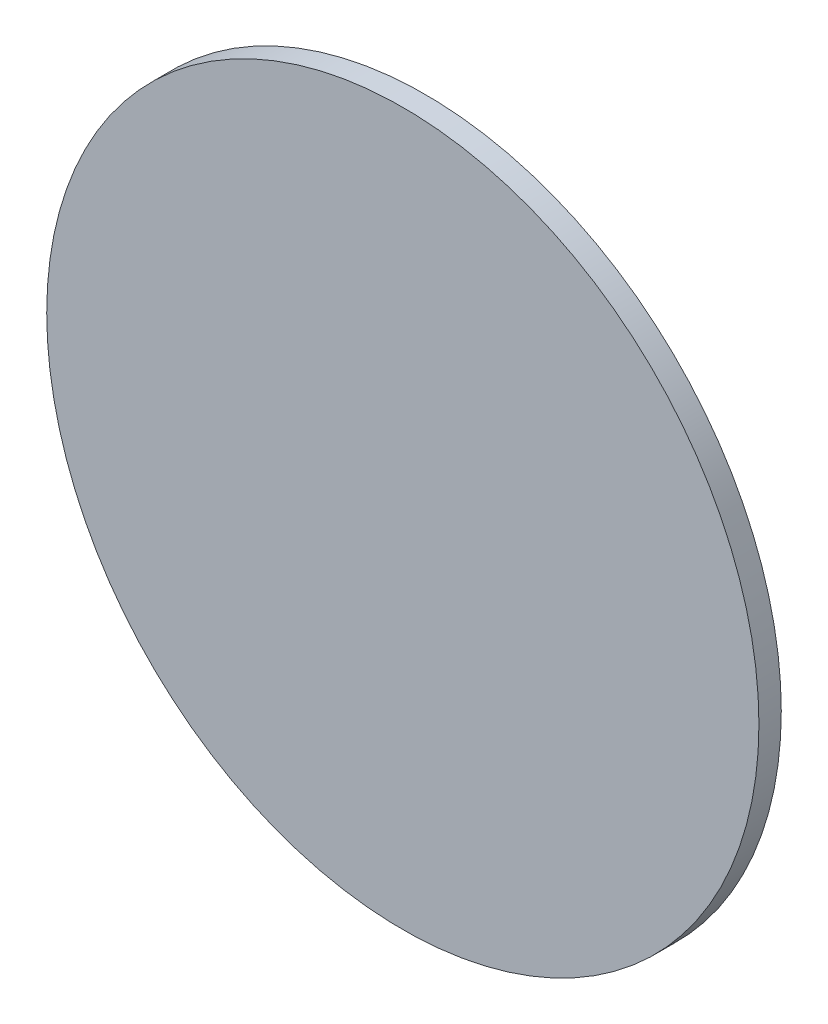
SolidWorks part; units mm, degrees
ref_plane "Plan de face" through (0, 0, 0) normal (0, 0, 1) x (1, 0, 0)
ref_plane "Plan de dessus" through (0, 0, 0) normal (0, 1, 0) x (1, 0, 0)
ref_plane "Plan de droite" through (0, 0, 0) normal (1, 0, 0) x (0, 0, -1)
sketch "Esquisse1" plane through (0, 0, 0) normal (0, 0, 1) x (1, 0, 0)
  circle A0 centre (0, 0) radius 350.525
  dimension "D1" = 701.05
extrude "Extrusion1" add sketch "Esquisse1" along normal blind 22
sketch "Esquisse2" plane through (0, 0, 22) normal (0, 0, 1) x (1, 0, 0)
  circle A0 centre (0, 0) radius 63.7192
